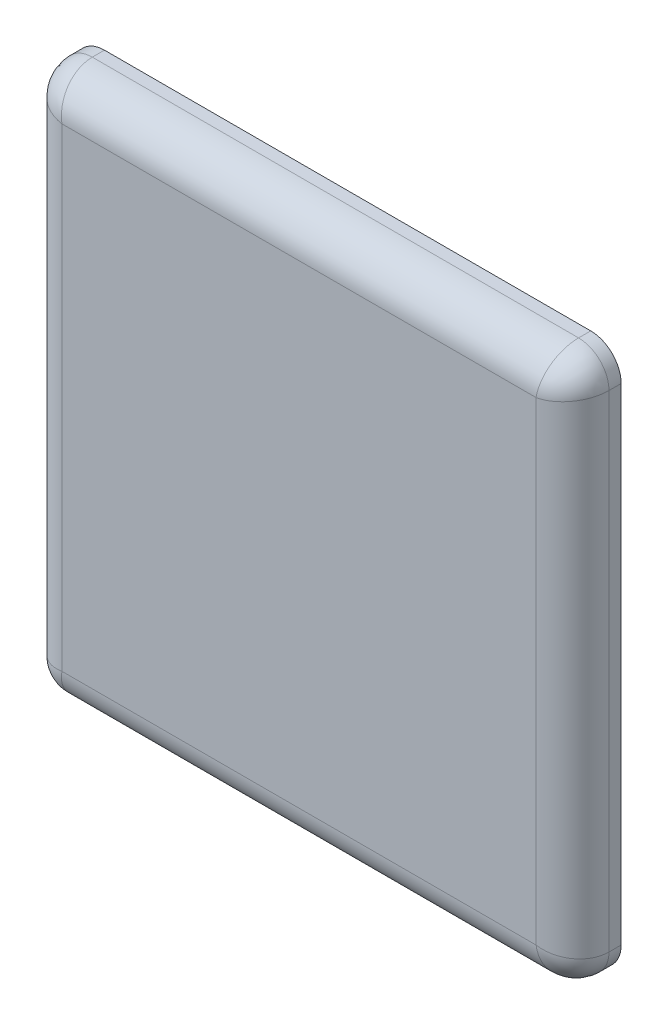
SolidWorks part; units mm, degrees
ref_plane "Front Plane" through (0, 0, 0) normal (0, 0, 1) x (1, 0, 0)
ref_plane "Top Plane" through (0, 0, 0) normal (0, 1, 0) x (1, 0, 0)
ref_plane "Right Plane" through (0, 0, 0) normal (1, 0, 0) x (0, 0, -1)
sketch "Sketch1" plane through (0, 0, 0) normal (0, 0, 1) x (1, 0, 0)
  line L0 (-22.5, 0) -> (22.5, 0) construction
  line L1 (-22.5, 22.5) -> (22.5, 22.5)
  line L2 (-22.5, 22.5) -> (-22.5, -22.5)
  line L3 (-22.5, -22.5) -> (22.5, -22.5)
  line L4 (22.5, 22.5) -> (22.5, -22.5)
  line L5 (0, 22.5) -> (0, -22.5) construction
  dimension "D1" = 45
  dimension "D2" = 45
extrude "Boss-Extrude1" add sketch "Sketch1" along normal blind 4
fillet "Fillet1" radius 2.5 4 edges at (-22.5, -22.5, 2) (22.5, -22.5, 2) (22.5, 22.5, 2) (-22.5, 22.5, 2)
fillet "Fillet2" radius 3 8 edges at (-21.7678, 21.7678, 4) (0, 22.5, 4) (21.7678, 21.7678, 4) (22.5, 0, 4) (21.7678, -21.7678, 4) (0, -22.5, 4) (-21.7678, -21.7678, 4) (-22.5, 0, 4)
sketch "Sketch2" plane through (0, 0, 0) normal (0, 0, -1) x (-1, 0, 0)
  line L1 (17, -17) -> (-17, -17)
  line L2 (17, -17) -> (17, 17)
  line L3 (17, 17) -> (-17, 17)
  line L4 (-17, -17) -> (-17, 17)
  line L5 (17, -17) -> (-17, 17) construction
  line L6 (17, 17) -> (-17, -17) construction
  point P0 (0, 0)
  dimension "D1" = 34
  dimension "D2" = 34
extrude "Cut-Extrude1" cut sketch "Sketch2" against normal blind 1
sketch "Sketch3" plane through (0, 0, 0) normal (1, 0, 0) x (0, 0, -1)
  line L0 (0, 17) -> (4, 17)
  line L1 (0, 17) -> (-1, 17)
  line L2 (4, 17) -> (4, 15.6)
  line L3 (4, 15.6) -> (0, 14.5)
  line L4 (0, 14.5) -> (0, 17) construction
  line L5 (0, 22.5) -> (0, -22.5) construction
  line L6 (0, 14.5) -> (-1, 14.5)
  line L7 (-1, 14.5) -> (-1, 17)
  dimension "D1" = 2.5
  dimension "D2" = 4
  dimension "D3" = 1.4
extrude "Boss-Extrude2" add sketch "Sketch3" along normal mid plane 10.2
fillet "Fillet3" radius 1 2 edges at (-5.1, 16.3, -4) (5.1, 16.3, -4)
sketch "Sketch4" plane through (0, 0, 1) normal (0, 0, -1) x (-1, 0, 0)
  line L0 (2.5456, 2.5456) -> (-2.5456, -2.5456) construction
  line L1 (-2.5456, 2.5456) -> (2.5456, -2.5456) construction
  line L2 (-3.1525, 1.7383) -> (-1.4142, 0)
  line L3 (1.7383, 3.1525) -> (0, 1.4142)
  line L4 (-1.7383, 3.1525) -> (0, 1.4142)
  line L5 (3.1525, 1.7383) -> (1.4142, 0)
  line L6 (-1.4142, 0) -> (-3.1525, -1.7383)
  line L7 (0, -1.4142) -> (1.7383, -3.1525)
  line L8 (1.7383, 3.1525) -> (-3.2527, -1.8385) construction
  line L9 (1.4142, 0) -> (3.1525, -1.7383)
  line L10 (-3.2527, 1.8385) -> (1.8385, -3.2527) construction
  line L11 (0, -1.4142) -> (-1.7383, -3.1525)
  line L12 (-1.8385, 3.2527) -> (3.2527, -1.8385) construction
  line L13 (2.4454, 2.4454) -> (-2.5456, -2.5456) construction
  line L14 (3.1525, 1.7383) -> (-1.8385, -3.2527) construction
  line L15 (-1.4142, 0) -> (1.4142, 0) construction
  arc A0 (-1.7383, 3.1525) -> (-3.1525, 1.7383) centre (0, 0) ccw
  arc A1 (3.1525, 1.7383) -> (1.7383, 3.1525) centre (0, 0) ccw
  arc A2 (1.7383, -3.1525) -> (3.1525, -1.7383) centre (0, 0) ccw
  arc A3 (-3.1525, -1.7383) -> (-1.7383, -3.1525) centre (0, 0) ccw
  circle A4 centre (0, 0) radius 3.6 construction
  point P28 (0, 3.6)
  dimension "D1" = 7.2
  dimension "D2" = 1
  dimension "D3" = 1
extrude "Boss-Extrude3" add sketch "Sketch4" along normal blind 9
sketch "Sketch5" plane through (0, 0, 0) normal (1, 0, 0) x (0, 0, -1)
  line L0 (0, 0) -> (8, 0) construction
  line L2 (5, 3.6) -> (8, 3.6)
  line L3 (8, 3.6) -> (8, 2.6515)
  line L4 (8, 1.7383) -> (8, 3.1525) construction
  line L5 (7.5868, 3.1439) -> (5, 3.6)
  arc A0 (8, 2.6515) -> (7.5868, 3.1439) centre (7.5, 2.6515) ccw
  dimension "D1" = 0.5
  dimension "D2" = 10
  dimension "D3" = 3
revolve "Cut-Revolve1" cut sketch "Sketch5" angle 360 about L0
sketch "Sketch6" plane through (0, 0, 1) normal (0, 0, -1) x (-1, 0, 0)
  line L0 (0, 6) -> (0, -6) construction
  line L1 (-1, 5) -> (-1, -5)
  line L2 (1, 5) -> (1, -5)
  line L3 (0, 3.5) -> (0, -6) construction
  line L4 (1, 3.5) -> (1, -6) construction
  line L5 (-1, 3.5) -> (-1, -6) construction
  circle A0 centre (0, 0) radius 6 construction
  arc A1 (1, 5) -> (-1, 5) centre (0, 5) ccw
  arc A2 (-1, -5) -> (1, -5) centre (0, -5) ccw
  dimension "D1" = 12
  dimension "D2" = 2
extrude "Boss-Extrude4" add sketch "Sketch6" along normal blind 1
